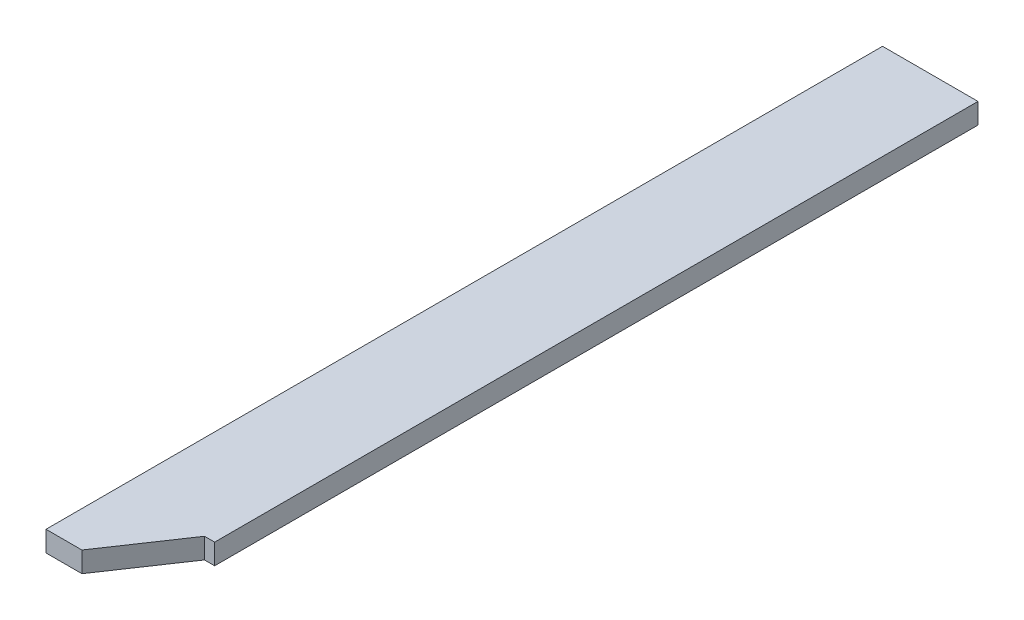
SolidWorks part; units mm, degrees
ref_plane "Front Plane" through (0, 0, 0) normal (0, 0, 1) x (1, 0, 0)
ref_plane "Top Plane" through (0, 0, 0) normal (0, 1, 0) x (1, 0, 0)
ref_plane "Right Plane" through (0, 0, 0) normal (1, 0, 0) x (0, 0, -1)
sketch "Sketch1" plane through (0, 0, 0) normal (0, 1, 0) x (1, 0, 0)
  line L1 (-295.275, 2587.6707) -> (295.275, 2587.6707)
  line L2 (-295.275, 2587.6707) -> (-295.275, -2587.6707)
  line L3 (-295.275, -2587.6707) -> (295.275, -2587.6707)
  line L4 (295.275, 2587.6707) -> (295.275, -2587.6707)
  line L5 (-295.275, 2587.6707) -> (295.275, -2587.6707) construction
  line L6 (-295.275, -2587.6707) -> (295.275, 2587.6707) construction
  point P0 (0, 0)
  dimension "D1" = 590.55
  dimension "D2" = 5175.3414
extrude "Boss-Extrude1" add sketch "Sketch1" along normal blind 127
sketch "Sketch2" plane through (0, 0, 0) normal (0, -1, 0) x (1, 0, 0)
  line L0 (295.275, 2587.6707) -> (295.275, 2134.9333)
  line L1 (295.275, 2587.6707) -> (295.275, -2587.6707) construction
  line L2 (2607.2502, 2134.9333) -> (232.3502, 2134.9333) construction
  line L3 (295.275, 2134.9333) -> (232.3502, 2134.9333)
  line L4 (232.3502, 2134.9333) -> (-73.025, 2587.6707)
  line L5 (-295.275, 2587.6707) -> (295.275, 2587.6707) construction
  line L6 (232.3502, 2134.9333) -> (-73.025, 2587.6707) construction
  line L7 (-73.025, 2587.6707) -> (295.275, 2587.6707)
extrude "Cut-Extrude1" cut sketch "Sketch2" against normal through all
